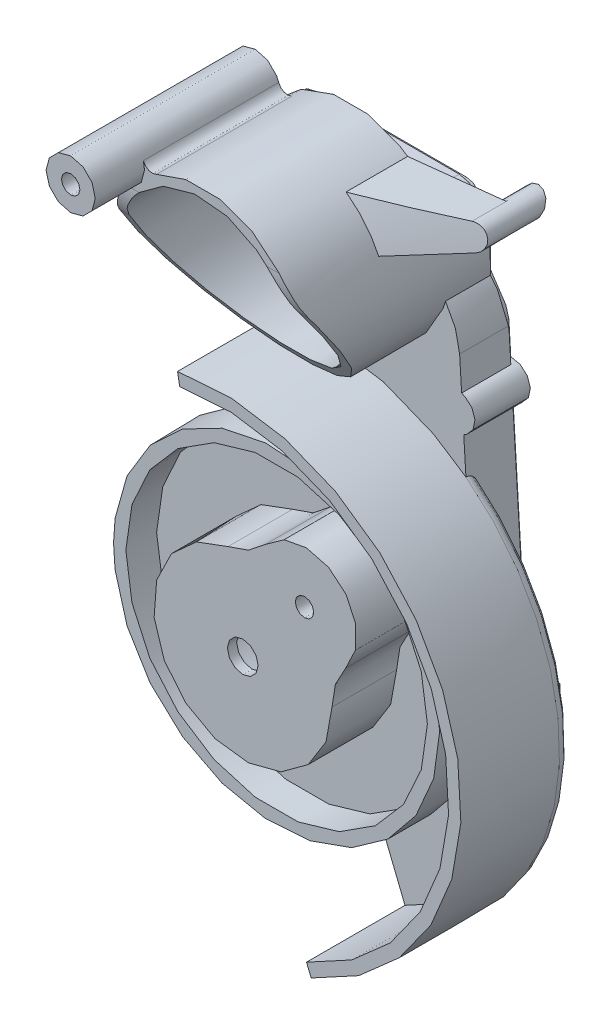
SolidWorks part; units mm, degrees
ref_plane "Face" through (0, 0, 0) normal (0, 0, 1) x (1, 0, 0)
ref_plane "Dessus" through (0, 0, 0) normal (0, 1, 0) x (1, 0, 0)
ref_plane "Droite" through (0, 0, 0) normal (1, 0, 0) x (0, 0, -1)
ref_plane "Face-Carter roue_Rendre symétrique" through (0, 0, -16) normal (0, 0, -1) x (1, 0, 0)
ref_plane "Dessus-Carter roue_Rendre symétrique" through (0, 0, -16) normal (0, 1, 0) x (1, 0, 0)
ref_plane "Droite-Carter roue_Rendre symétrique" through (0, 0, -16) normal (1, 0, 0) x (0, 0, 1)
ref_plane "Plan1-Carter roue_Rendre symétrique" through (0, 0, -34) normal (0, 0, -1) x (1, 0, 0)
ref_plane "Plan2-Carter roue_Rendre symétrique" through (30, 0, -24) normal (1, 0, 0) x (0, 0, 1)
ref_plane "Plan3-Carter roue_Rendre symétrique" through (29, 0, -24) normal (1, 0, 0) x (0, 0, 1)
ref_plane "Plan4-Carter roue_Rendre symétrique" through (29, 0, -24) normal (1, 0, 0) x (0, 0, 1)
mirrored part "Carter roue_Rendre symétrique"
other "<Carter roue>-<Enlèv. mat.-Extru.8>"
